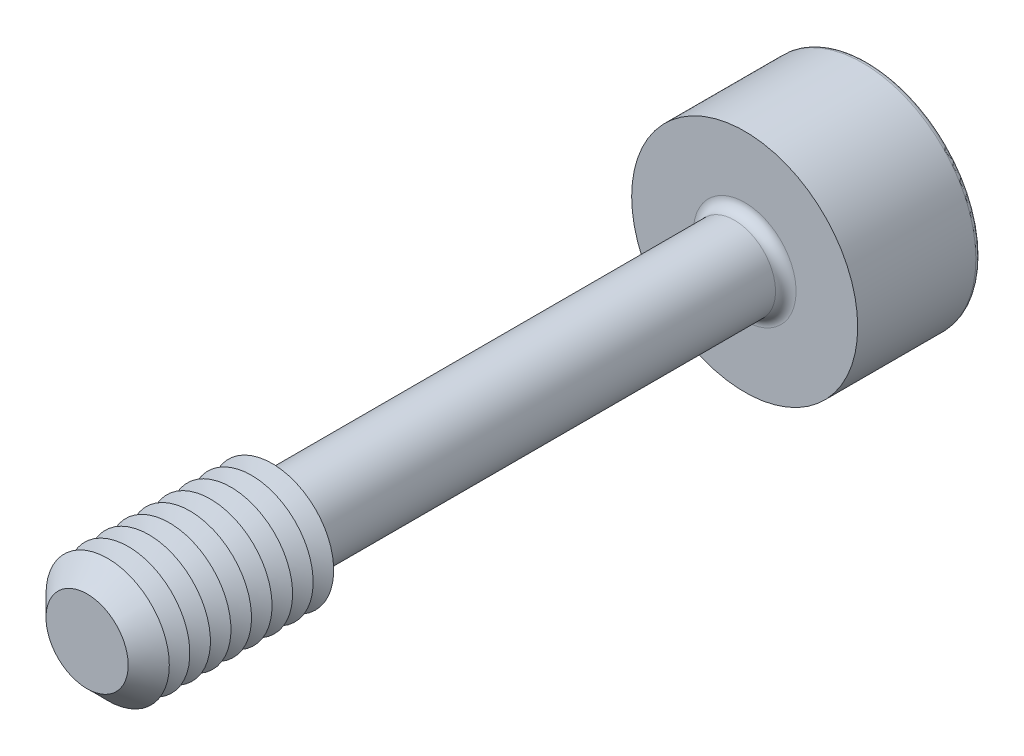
SolidWorks part; units mm, degrees
ref_plane "Front Plane" through (0, 0, 0) normal (0, 0, 1) x (1, 0, 0)
ref_plane "Top Plane" through (0, 0, 0) normal (0, 1, 0) x (1, 0, 0)
ref_plane "Right Plane" through (0, 0, 0) normal (1, 0, 0) x (0, 0, -1)
sketch "Sketch1" plane through (0, 0, 0) normal (0, 0, 1) x (1, 0, 0)
  circle A0 centre (0, 0) radius 1
  dimension "D1" = 2
extrude "Extrude1" add sketch "Sketch1" along normal mid plane 16
sketch "Sketch2" plane through (0, 0, 0) normal (1, 0, 0) x (0, 0, -1)
  line L0 (-8, 0) -> (-8, 1.5)
  line L1 (-8, 1) -> (-8, -1) construction
  line L2 (-8, 1.5) -> (-3.5, 1.5)
  line L3 (-3.5, 1.5) -> (-3.2113, 1)
  line L4 (8, 1) -> (-8, 1) construction
  line L5 (-3.2113, 1) -> (-3.2113, 0)
  line L6 (-3.2113, 0) -> (-8, 0)
  dimension "D1" = 1.5
  dimension "D2" = 120
  dimension "D3" = 4.5
revolve "Revolve1" add sketch "Sketch2" angle 360 about L6
chamfer "Chamfer1" distance 0.5 angle 45 1 edges at (0, 1.5, 8)
sketch "Sketch3" plane through (0, 0, -8) normal (0, 0, -1) x (-1, 0, 0)
  circle A0 centre (0, 0) radius 2.75
  dimension "D1" = 5.5
extrude "Extrude2" add sketch "Sketch3" along normal blind 3
sketch "Sketch4" plane through (-13.7, 0, -11) normal (0, 0, 1) x (1, 0, 0)
  line L2 (12.9783, -1.25) -> (14.4217, -1.25)
  line L3 (14.4217, -1.25) -> (15.1434, 0)
  line L4 (15.1434, 0) -> (14.4217, 1.25)
  line L6 (14.4217, 1.25) -> (12.9783, 1.25)
  line L7 (12.9783, 1.25) -> (12.2566, 0)
  line L8 (12.2566, 0) -> (12.9783, -1.25)
  circle A0 centre (13.7, 0) radius 1.25 construction
  dimension "D1" = 2.5
extrude "Extrude3" cut sketch "Sketch4" along normal blind 2.5
fillet "Fillet1" radius 0.25 1 edges at (-1, 0, -8)
fillet "Fillet2" radius 0.125 1 edges at (-2.75, 0, -11)
sketch "Sketch5" plane through (0, 0, 0) normal (1, 0, 0) x (0, 0, -1)
  line L0 (8.5, 0) -> (8.5, -1.25)
  line L1 (8.5, -1.25) -> (7.7783, 0)
  line L2 (7.7783, 0) -> (8.5, 0)
  dimension "D1" = 30
revolve "Cut-Revolve1" cut sketch "Sketch5" angle 360 about L2
sketch "Sketch6" plane through (0, 0, 0) normal (1, 0, 0) x (0, 0, -1)
  line L0 (1.332, 0) -> (-13.289, 0) construction
sketch "Sketch7" plane through (0, 0, 0) normal (1, 0, 0) x (0, 0, -1)
  line L0 (-3.5, 1.5) -> (-3.75, 1.067)
  line L1 (-3.75, 1.067) -> (-4, 1.5)
  line L2 (-3.5, 1.5) -> (-7.5, 1.5) construction
  line L3 (-4, 1.5) -> (-3.5, 1.5)
  dimension "D1" = 0.5
revolve "Cut-Revolve2" cut sketch "Sketch7" angle 360 about L0
pattern_linear "LPattern1" count 8 spacing 0.5 along (0, 0, 1) of "Cut-Revolve2"
